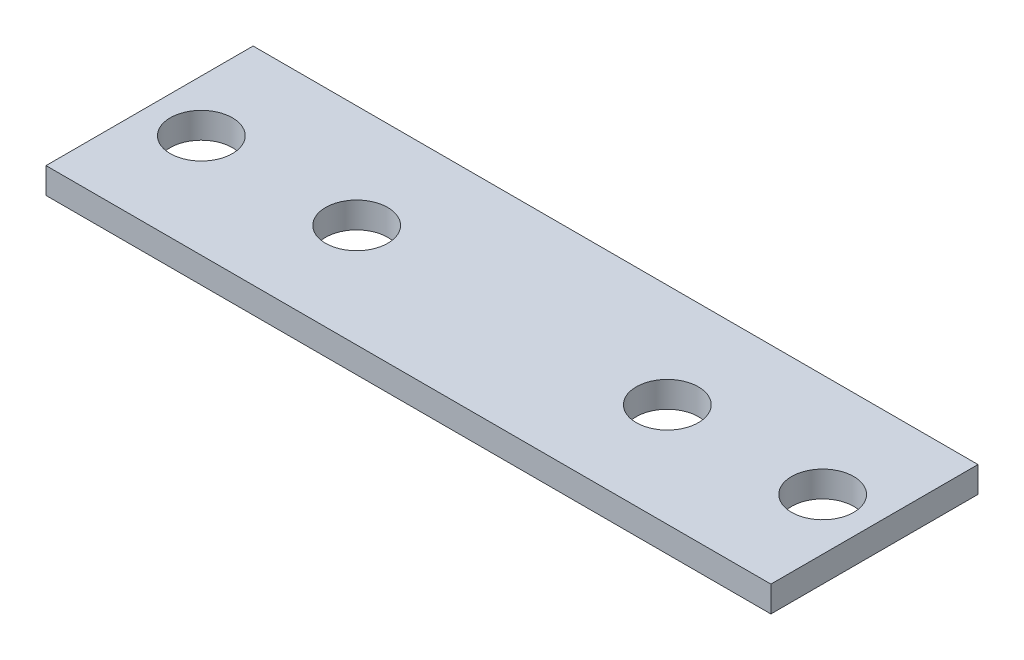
SolidWorks part; units mm, degrees
ref_plane "Plan de face" through (0, 0, 0) normal (0, 0, 1) x (1, 0, 0)
ref_plane "Plan de dessus" through (0, 0, 0) normal (0, 1, 0) x (1, 0, 0)
ref_plane "Plan de droite" through (0, 0, 0) normal (1, 0, 0) x (0, 0, -1)
sketch "Esquisse1" plane through (0, 0, 0) normal (0, 1, 0) x (1, 0, 0)
  line L0 (10, 20) -> (130, 20) construction
  line L1 (0, 0) -> (140, 0)
  line L2 (0, 0) -> (0, 40)
  line L3 (0, 40) -> (140, 40)
  line L4 (140, 0) -> (140, 40)
  circle A0 centre (10, 20) radius 6
  circle A1 centre (130, 20) radius 6
  circle A2 centre (40, 20) radius 6
  circle A3 centre (100, 20) radius 6
  dimension "D3" = 12
  dimension "D4" = 12
  dimension "D6" = 12
  dimension "D7" = 12
  dimension "D9" = 30
  dimension "D1" = 40
  dimension "D2" = 140
  dimension "D5" = 20
  dimension "D8" = 30
  dimension "D10" = 60
  dimension "D11" = 10
extrude "Extrusion1" add sketch "Esquisse1" along normal blind 5
